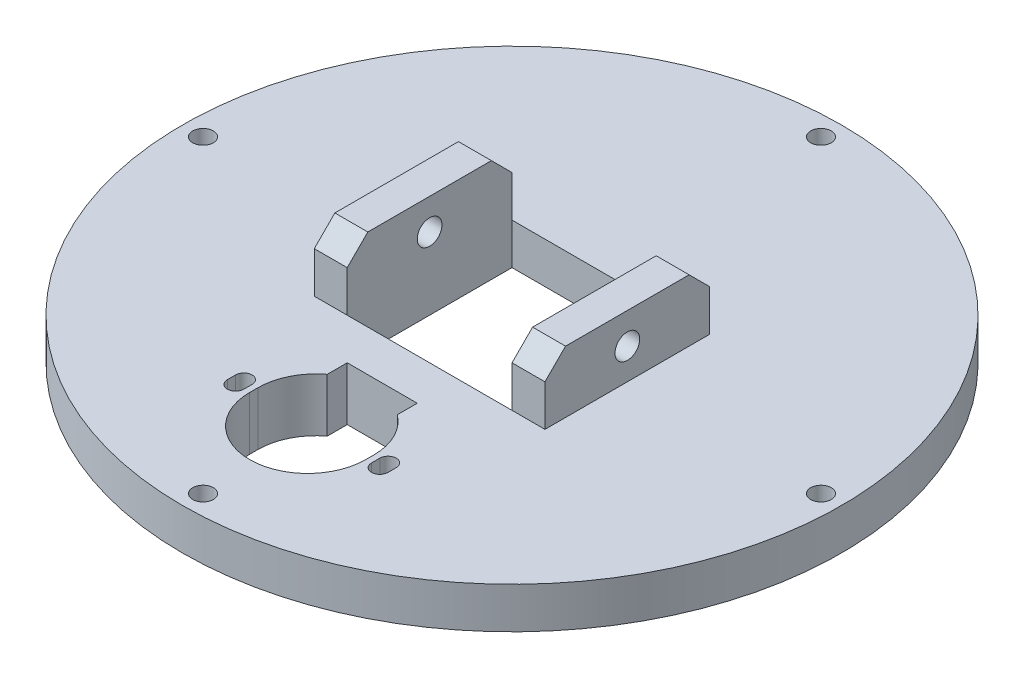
SolidWorks part; units mm, degrees
ref_plane "Front Plane" through (0, 0, 0) normal (0, 0, 1) x (1, 0, 0)
ref_plane "Top Plane" through (0, 0, 0) normal (0, 1, 0) x (1, 0, 0)
ref_plane "Right Plane" through (0, 0, 0) normal (1, 0, 0) x (0, 0, -1)
sketch "Sketch1" plane through (0, 0, 0) normal (0, 1, 0) x (1, 0, 0)
  circle A0 centre (0, 0) radius 80
  dimension "D1" = 160
extrude "Boss-Extrude1" add sketch "Sketch1" along normal blind 10 contours A0
sketch "Sketch2" plane through (0, 10, 0) normal (0, 1, 0) x (1, 0, 0)
  circle A0 centre (0, 0) radius 75 construction
  circle A1 centre (-75, 0) radius 2.5
  circle A2 centre (0, 75) radius 2.5
  circle A3 centre (75, 0) radius 2.5
  circle A4 centre (0, -75) radius 2.5
  point P3 (0, 75)
  point P4 (75, 0)
  point P5 (0, -75)
  point P6 (-75, 0)
  point P7 (-75, 0)
  dimension "D1" = 150
extrude "Cut-Extrude1" cut sketch "Sketch2" against normal up to next
sketch "Sketch3" plane through (0, 10, 0) normal (0, 1, 0) x (1, 0, 0)
  line L1 (-20, 20) -> (20, 20)
  line L2 (-20, 20) -> (-20, -20)
  line L3 (-20, -20) -> (20, -20)
  line L4 (20, 20) -> (20, -20)
  dimension "D1" = 40
  dimension "D2" = 20
  dimension "D3" = 20
extrude "Cut-Extrude2" cut sketch "Sketch3" against normal up to next
sketch "Sketch4" plane through (0, 10, 0) normal (0, 1, 0) x (1, 0, 0)
  line L0 (-1.5, -46.1) -> (-1.5, -48.1) construction
  line L5 (-1.5, -46.1) -> (-1.5, -48.1) construction
  line L6 (0, 0) -> (0, -72.5) construction
  line L7 (0, 0) -> (-72.5, 0) construction
  line L8 (12.5, -46.1) -> (-15.5, -46.1) construction
  line L11 (7, -34.8501) -> (-10, -34.8501)
  line L14 (7, -34.8501) -> (7, -30)
  line L17 (7, -30) -> (-10, -30)
  line L20 (-10, -34.8501) -> (-10, -30)
  line L21 (12.6, -46.1) -> (12.6, -48.1)
  line L22 (-15.6, -46.1) -> (-15.6, -48.1)
  line L23 (16, -46.1) -> (16, -48.1)
  line L24 (16, -46.1) -> (16, -48.1) construction
  line L25 (18, -46.1) -> (18, -48.1)
  line L26 (14, -46.1) -> (14, -48.1)
  line L27 (-19, -46.1) -> (-19, -48.1)
  line L28 (-19, -46.1) -> (-19, -48.1) construction
  line L29 (-21, -46.1) -> (-21, -48.1)
  line L30 (-17, -46.1) -> (-17, -48.1)
  line L31 (16, -47.1) -> (-1.5, -47.1) construction
  circle A10 centre (0, -75) radius 2.5 construction
  circle A11 centre (-75, 0) radius 2.5 construction
  arc A16 (12.6, -46.1) -> (-15.6, -46.1) centre (-1.5, -46.1) ccw
  arc A17 (-15.6, -48.1) -> (12.6, -48.1) centre (-1.5, -48.1) ccw
  arc A18 (18, -46.1) -> (14, -46.1) centre (16, -46.1) ccw
  arc A19 (14, -48.1) -> (18, -48.1) centre (16, -48.1) ccw
  arc A20 (-21, -46.1) -> (-17, -46.1) centre (-19, -46.1) cw
  arc A21 (-17, -48.1) -> (-21, -48.1) centre (-19, -48.1) cw
  point P8 (16, -47.1)
  point P13 (16, -46.1)
  point P14 (-1.5, -32)
  point P20 (-1.5, -47.1)
  point P31 (-19, -47.1)
  dimension "D5" = 30
  dimension "D8" = 2
  dimension "D9" = 14.1
  dimension "D1" = 2
  dimension "D7" = 2
  dimension "D2" = 17
  dimension "D3" = 2
  dimension "D4" = 10
  dimension "D6" = 17.5
extrude "Cut-Extrude3" cut sketch "Sketch4" against normal up to next
sketch "Sketch5" plane through (0, 10, 0) normal (0, 1, 0) x (1, 0, 0)
  line L0 (-20, -20) -> (20, -20) construction
  line L1 (-20, 20) -> (-28, 20)
  line L2 (-20, 20) -> (-20, -20)
  line L3 (-20, -20) -> (-28, -20)
  line L4 (-28, 20) -> (-28, -20)
  dimension "D1" = 8
extrude "Boss-Extrude2" add sketch "Sketch5" along normal blind 15
fillet "Fillet1" radius 5 2 edges at (-24, 25, -20) (-24, 25, 20)
sketch "Sketch6" plane through (-28, 0, 0) normal (-1, 0, 0) x (0, 0, 1)
  line L0 (-15, 25) -> (15, 25) construction
  line L2 (20, 20) -> (20, 10) construction
  circle A0 centre (0, 17.5) radius 3
  dimension "D1" = 6
  dimension "D2" = 7.5
  dimension "D3" = 20
extrude "Cut-Extrude4" cut sketch "Sketch6" against normal up to next
ref_plane "Plane1" [suppressed] through (0, 0, 0) normal (-1, 0, 0) x (0, 0, 1)
mirror "Mirror1" about plane through (0, 0, 0) normal (-1, 0, 0) of "Cut-Extrude4", "Fillet1", "Boss-Extrude2"
sketch "Sketch7" plane through (0, 0, 0) normal (0, -1, 0) x (1, 0, 0)
  line L0 (-1.5, 25) -> (-1.5, 65) construction
  line L1 (-26.5, 65) -> (23.5, 65)
  line L2 (-26.5, 65) -> (-26.5, 25)
  line L3 (-26.5, 25) -> (23.5, 25)
  line L4 (23.5, 65) -> (23.5, 25)
  line L5 (7, 30) -> (7, 34.8501) construction
  line L8 (-26.5, 45) -> (23.5, 45)
  line L9 (-10, 30) -> (7, 30) construction
  dimension "D1" = 8.5
  dimension "D2" = 15
  dimension "D3" = 40
  dimension "D4" = 50
extrude "Boss-Extrude3" add sketch "Sketch7" along normal blind 3
fillet "Fillet2" radius 10 4 edges at (-26.5, -1.5, 25) (23.5, -1.5, 25) (23.5, -1.5, 65) (-26.5, -1.5, 65)
